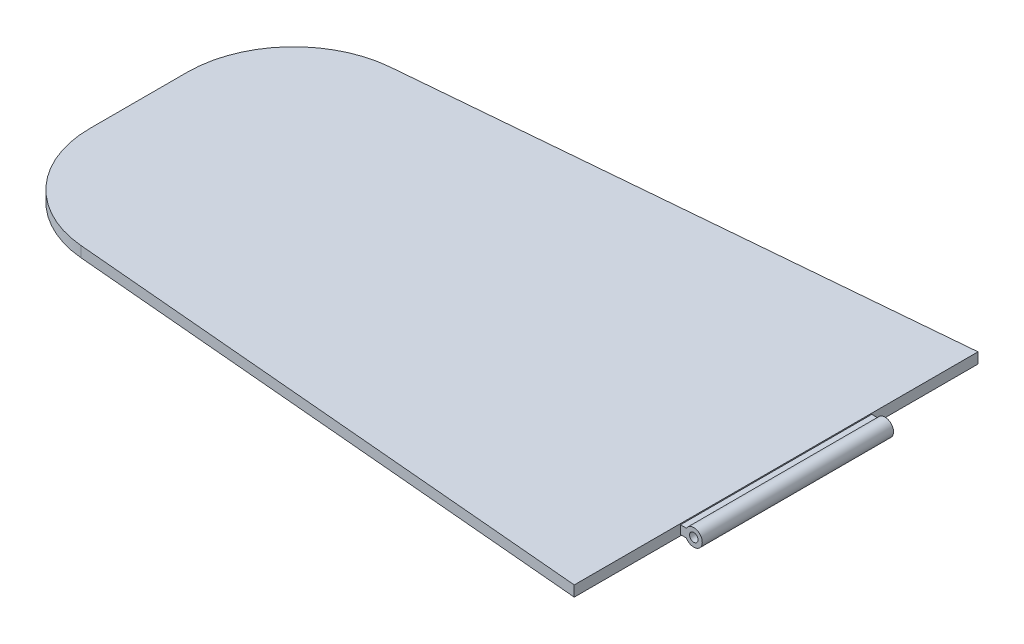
SolidWorks part; units mm, degrees
ref_plane "Front Plane" through (0, 0, 0) normal (0, 0, 1) x (1, 0, 0)
ref_plane "Top Plane" through (0, 0, 0) normal (0, 1, 0) x (1, 0, 0)
ref_plane "Right Plane" through (0, 0, 0) normal (1, 0, 0) x (0, 0, -1)
sketch "Sketch1" plane through (0, 0, 0) normal (0, 1, 0) x (1, 0, 0)
  line L0 (0, 190) -> (0, -190)
  line L1 (0, -190) -> (-508.7156, -145.4932)
  line L2 (0, 190) -> (-508.7156, 145.4932)
  line L3 (-600, 0) -> (0, 0) construction
  line L4 (-600, 45.8737) -> (-600, -45.8737)
  arc A0 (-508.7156, -145.4932) -> (-600, -45.8737) centre (-500, -45.8737) cw
  arc A1 (-508.7156, 145.4932) -> (-600, 45.8737) centre (-500, 45.8737) ccw
  dimension "D3" = 100
  dimension "D1" = 380
  dimension "D2" = 600
  dimension "D4" = 10
extrude "Boss-Extrude1" add sketch "Sketch1" along normal blind 10
sketch "Sketch2" plane through (0, 0, 0) normal (0, 0, 1) x (1, 0, 0)
  line L0 (0, 5) -> (32.2448, 5) construction
  line L1 (0, 10) -> (0, 0) construction
  line L3 (0, 9) -> (5.5718, 9)
  line L4 (0, 9) -> (0, 1)
  line L5 (0, 1) -> (5.5718, 1)
  circle A0 centre (12.5, 5) radius 4
  arc A1 (5.5718, 1) -> (5.5718, 9) centre (12.5, 5) ccw
  dimension "D2" = 8
  dimension "D3" = 4
  dimension "D1" = 8
  dimension "D4" = 12.5
extrude "Boss-Extrude2" add sketch "Sketch2" along normal mid plane 180
